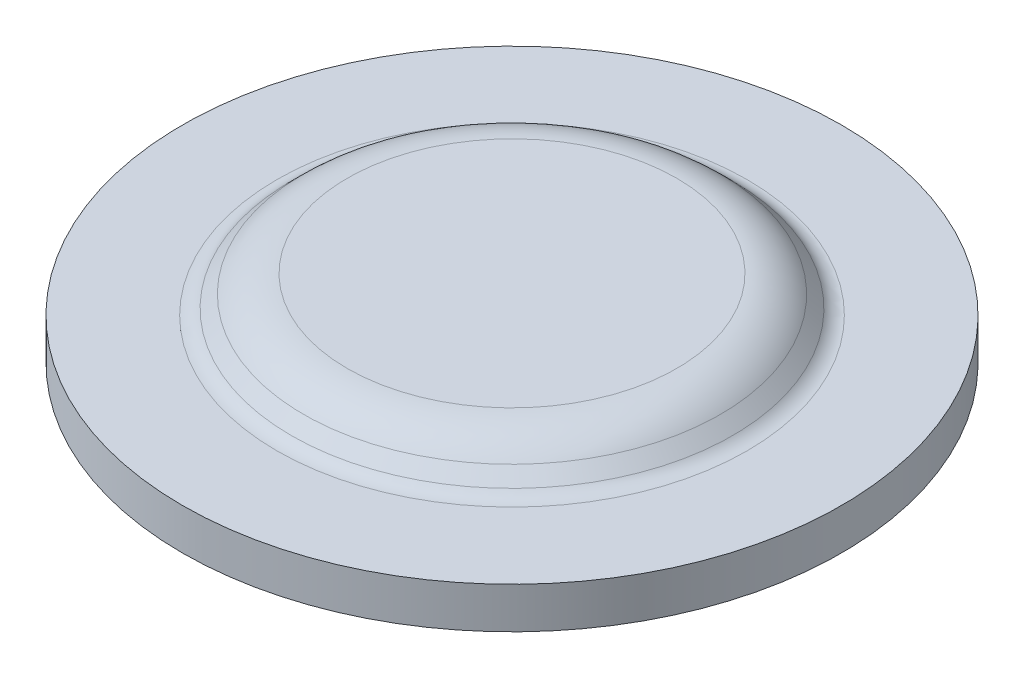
SolidWorks part; units mm, degrees
other "Revolve1"
ref_plane "Front Plane" through (0, 0, 0) normal (0, 0, 1) x (1, 0, 0)
ref_plane "Top Plane" through (0, 0, 0) normal (0, 1, 0) x (1, 0, 0)
ref_plane "Right Plane" through (0, 0, 0) normal (1, 0, 0) x (0, 0, -1)
imported_body "Imported1"
sketch "Sketch1" plane through (0, 0, 0) normal (0, 1, 0) x (1, 0, 0)
  circle A0 centre (0, 0) radius 25.4
  circle A1 centre (0, 0) radius 50.8548
  dimension "D1" = 50.8
extrude "Cut-Extrude1" cut sketch "Sketch1" against normal through all
